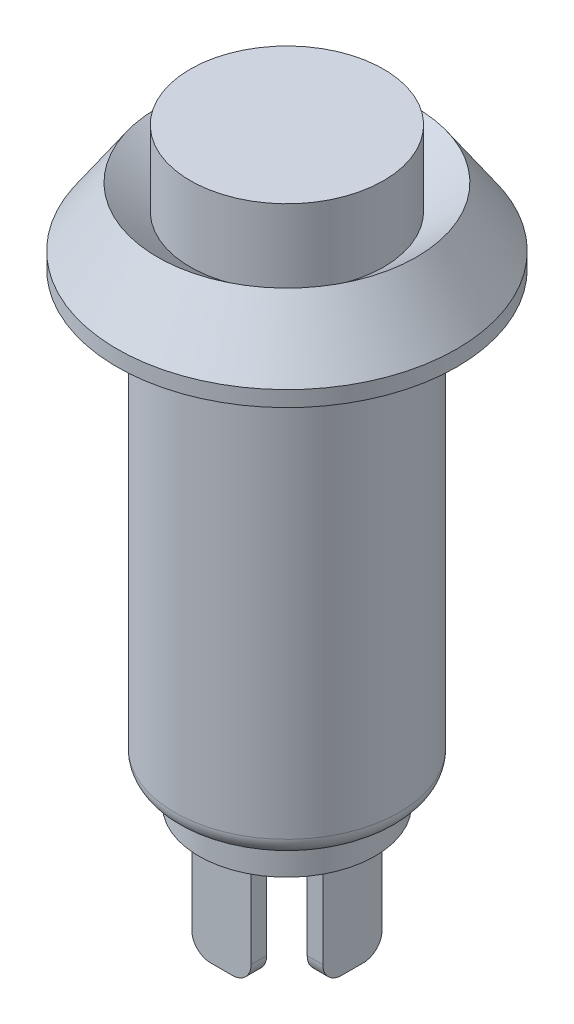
SolidWorks part; units mm, degrees
ref_plane "Plan de face" through (0, 0, 0) normal (0, 0, 1) x (1, 0, 0)
ref_plane "Plan de dessus" through (0, 0, 0) normal (0, 1, 0) x (1, 0, 0)
ref_plane "Plan de droite" through (0, 0, 0) normal (1, 0, 0) x (0, 0, -1)
sketch "Esquisse1" plane through (0, 0, 0) normal (0, 0, 1) x (1, 0, 0)
  line L0 (0, 0) -> (3.1, 0)
  line L1 (3.1, 0) -> (3.1, -2.4)
  line L2 (3.1, -2.4) -> (4.15, -1.6)
  line L3 (4.15, -1.6) -> (5.45, -3.5)
  line L4 (5.45, -3.5) -> (5.45, -4)
  line L5 (5.45, -4) -> (3.6, -4)
  line L6 (3.6, -4) -> (3.6, -17.9)
  line L7 (3.6, -17.9) -> (0, -17.9)
  line L8 (0, -17.9) -> (0, 0)
  dimension "D1" = 3.1
  dimension "D2" = 1.6
  dimension "D3" = 5.45
  dimension "D4" = 0.5
  dimension "D5" = 4.15
  dimension "D6" = 2.4
  dimension "D7" = 4
  dimension "D8" = 13.9
  dimension "D9" = 3.6
revolve "Révolution1" add sketch "Esquisse1" angle 360 about L8
sketch "Esquisse2" plane through (0, -17.9, 0) normal (0, -1, 0) x (1, 0, 0)
  circle A0 centre (0, 0) radius 2.825
  dimension "D1" = 5.65
extrude "Boss.-Extru.1" add sketch "Esquisse2" along normal blind 1
sketch "Esquisse3" plane through (0, -18.9, 0) normal (0, -1, 0) x (1, 0, 0)
  line L0 (0, 0) -> (0, 1.85) construction
  line L1 (-0.95, 2.1) -> (0.95, 2.1)
  line L2 (-0.95, 2.1) -> (-0.95, 1.6)
  line L3 (-0.95, 1.6) -> (0.95, 1.6)
  line L4 (0.95, 2.1) -> (0.95, 1.6)
  line L5 (-0.95, 2.1) -> (0.95, 1.6) construction
  line L6 (-0.95, 1.6) -> (0.95, 2.1) construction
  line L7 (2.1, 0.95) -> (1.6, 0.95)
  line L8 (2.1, 0.95) -> (2.1, -0.95)
  line L9 (2.1, -0.95) -> (1.6, -0.95)
  line L10 (1.6, 0.95) -> (1.6, -0.95)
  line L11 (0.95, -2.1) -> (0.95, -1.6)
  line L12 (0.95, -2.1) -> (-0.95, -2.1)
  line L13 (-0.95, -2.1) -> (-0.95, -1.6)
  line L14 (0.95, -1.6) -> (-0.95, -1.6)
  line L15 (-2.1, -0.95) -> (-1.6, -0.95)
  line L16 (-2.1, -0.95) -> (-2.1, 0.95)
  line L17 (-2.1, 0.95) -> (-1.6, 0.95)
  line L18 (-1.6, -0.95) -> (-1.6, 0.95)
  point P0 (0, 1.85)
  point P23 (0, 0)
  dimension "D1" = 0.5
  dimension "D2" = 1.85
  dimension "D3" = 1.9
  dimension "D4" = 4
extrude "Boss.-Extru.2" add sketch "Esquisse3" along normal blind 3.5
fillet "Congé1" radius 0.6 8 edges at (1.85, -22.4, -0.95) (1.85, -22.4, 0.95) (0.95, -22.4, 1.85) (-0.95, -22.4, 1.85) (-1.85, -22.4, 0.95) (-1.85, -22.4, -0.95) (0.95, -22.4, -1.85) (-0.95, -22.4, -1.85)
fillet "Congé2" radius 0.6 1 edges at (3.6, -17.9, 0)
